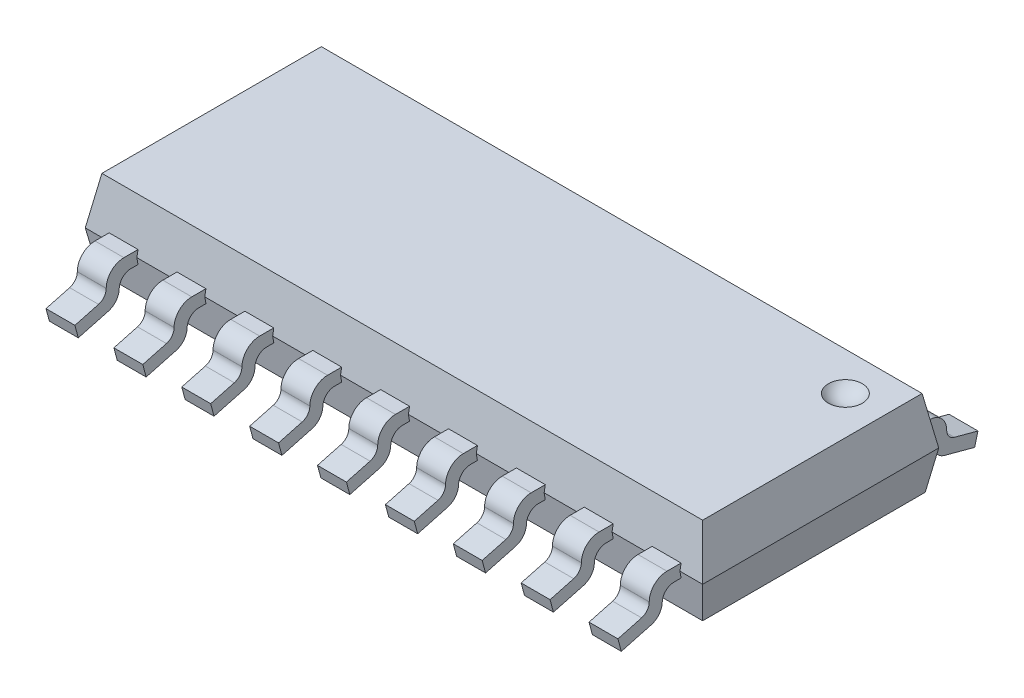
SolidWorks part; units mm, degrees
ref_plane "Front Plane" through (0, 0, 0) normal (0, 0, 1) x (1, 0, 0)
ref_plane "Top Plane" through (0, 0, 0) normal (0, 1, 0) x (1, 0, 0)
ref_plane "Right Plane" through (0, 0, 0) normal (1, 0, 0) x (0, 0, -1)
sketch "Sketch3" plane through (0, 0, 0) normal (1, 0, 0) x (0, 0, -1)
  line L0 (-2, 0) -> (2, 0) construction
  line L1 (-2, 0) -> (-1.8854, -0.65)
  line L2 (-1.8854, -0.65) -> (1.8854, -0.65)
  line L3 (1.8854, -0.65) -> (2, 0)
  line L4 (2, 0) -> (1.8589, 0.8)
  line L5 (1.8589, 0.8) -> (-1.8589, 0.8)
  line L6 (-1.8589, 0.8) -> (-2, 0)
  point P4 (0, 0)
  dimension "D1" = 4
  dimension "D2" = 1.45
  dimension "D3" = 0.65
  dimension "D4" = 100
  dimension "D5" = 100
  dimension "D6" = 100
  dimension "D7" = 100
extrude "Boss-Extrude1" add sketch "Sketch3" along normal mid plane 10.46
sketch "Sketch4" plane through (0, 0, 0) normal (0, 0, 1) x (1, 0, 0)
  line L0 (-5.23, 0) -> (-5.0889, 0.8)
  line L1 (5.23, 0.8) -> (-5.23, 0.8) construction
  line L2 (-5.0889, 0.8) -> (-6, 0.8)
  line L3 (-5.23, 0) -> (-5.1154, -0.65)
  line L4 (5.23, -0.65) -> (-5.23, -0.65) construction
  line L5 (-5.1154, -0.65) -> (-6, -0.65)
  line L6 (-6, -0.65) -> (-6, 0.8)
  line L7 (0, 0) -> (0, 1.6058) construction
  line L8 (6, -0.65) -> (6, 0.8)
  line L9 (5.1154, -0.65) -> (6, -0.65)
  line L10 (5.23, 0) -> (5.1154, -0.65)
  line L11 (5.0889, 0.8) -> (6, 0.8)
  line L12 (5.23, 0) -> (5.0889, 0.8)
  dimension "D1" = 80
  dimension "D2" = 80
  dimension "D3" = 6
extrude "Cut-Extrude1" cut sketch "Sketch4" against normal mid plane 8.75
ref_plane "Plane1" through (0, 1, 0) normal (0, 1, 0) x (1, 0, 0)
sketch "Sketch8" plane through (0, 0, 0) normal (1, 0, 0) x (0, 0, -1)
  line L0 (-2, 0) -> (-2.3016, 0) construction
  line L1 (-2, 0) -> (-1.9806, 0.11)
  line L2 (-2, 0) -> (-1.8589, 0.8) construction
  line L3 (-1.9806, 0.11) -> (-2.22, 0.11)
  line L4 (-2.6496, -0.3602) -> (-3.05, -0.4675)
  line L5 (-3.05, -0.4675) -> (-2.9931, -0.68)
  line L6 (-2.9931, -0.68) -> (-2.4853, -0.5439)
  line L7 (-2.3, -0.3025) -> (-2.3, -0.31)
  line L8 (-2.1, -0.11) -> (-1.9806, -0.11)
  line L9 (-1.8854, -0.65) -> (-2, 0) construction
  line L10 (-1.9806, -0.11) -> (-2, 0)
  line L11 (-2.52, -0.19) -> (-2.52, -0.1913)
  arc A0 (-2.22, 0.11) -> (-2.52, -0.19) centre (-2.22, -0.19) ccw
  arc A2 (-2.52, -0.1913) -> (-2.6496, -0.3602) centre (-2.6949, -0.1913) cw
  arc A3 (-2.4853, -0.5439) -> (-2.3, -0.3025) centre (-2.55, -0.3025) ccw
  arc A5 (-2.3, -0.31) -> (-2.1, -0.11) centre (-2.1, -0.31) cw
  point P10 (-2.5321, -0.0698)
  point P22 (-2.5329, -0.1977)
  point P26 (-2.5266, -0.1954)
  point P27 (0, 0)
  dimension "D4" = 0.25
  dimension "D6" = 0.2
  dimension "D8" = 0.3
  dimension "D1" = 1.05
  dimension "D2" = 0.22
  dimension "D3" = 0.75
  dimension "D5" = 0.22
  dimension "D7" = 0.22
  dimension "D9" = 105
  dimension "D10" = 0.68
extrude "Boss-Extrude3" add sketch "Sketch8" along normal mid plane 0.49
sketch "Sketch9" plane through (0, 1, 0) normal (0, 1, 0) x (1, 0, 0)
  line L0 (5.0889, 1.8589) -> (-5.0889, 1.8589) construction
  line L1 (5.0889, 1.8589) -> (5.0889, -1.8589) construction
  line L2 (4.7889, 1.2089) -> (4.0889, 1.2089)
  arc A0 (4.7889, 1.2089) -> (4.0889, 1.2089) centre (4.4389, 1.2089) ccw
  dimension "D3" = 0.7
  dimension "D1" = 0.65
  dimension "D2" = 0.65
revolve "Cut-Revolve1" cut sketch "Sketch9" angle 360 about L2
pattern_linear "LPattern1" count 5 spacing 1.15 along (1, 0, 0) count 5 spacing 1.15 along (-1, 0, 0) of "Boss-Extrude3"
mirror "Mirror1" about plane through (0, 0, 0) normal (0, 0, 1) of "Boss-Extrude3", "LPattern1"
